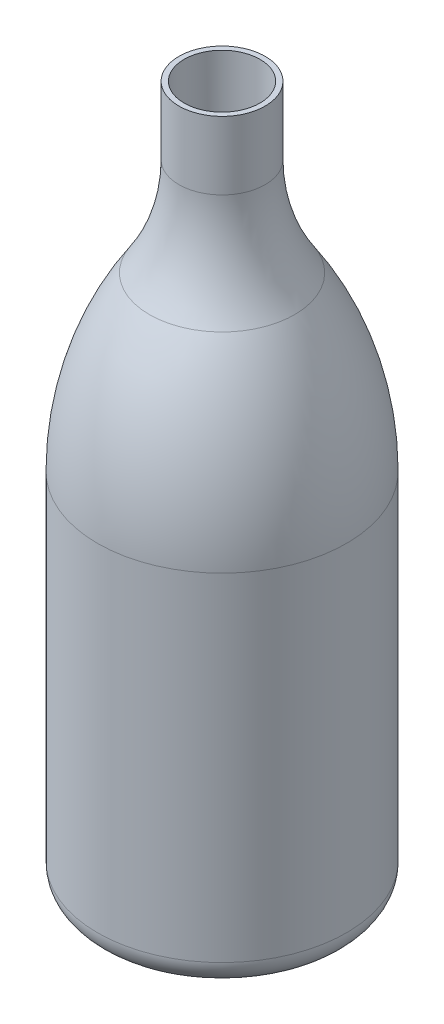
SolidWorks part; units mm, degrees
ref_plane "Front" through (0, 0, 0) normal (0, 0, 1) x (1, 0, 0)
ref_plane "Top" through (0, 0, 0) normal (0, 1, 0) x (1, 0, 0)
ref_plane "Right" through (0, 0, 0) normal (1, 0, 0) x (0, 0, -1)
sketch "Sketch1" plane through (0, 0, 0) normal (0, 0, 1) x (1, 0, 0)
  line L0 (0, 0) -> (24.0891, 0)
  line L1 (24.0891, 0) -> (24.0891, 70.2528)
  line L2 (8.3415, 122.4934) -> (8.3415, 135.6633)
  line L3 (8.3415, 135.6633) -> (0, 135.6633)
  line L4 (0, 135.6633) -> (0, 0)
  arc A0 (24.0891, 70.2528) -> (14.0474, 103.5647) centre (-36.1855, 70.2528) ccw
  arc A1 (14.0474, 103.5647) -> (8.3415, 122.4934) centre (42.5912, 122.4934) cw
revolve "Revolve1" add sketch "Sketch1" angle 360 about L4
fillet "Fillet1" radius 5 1 edges at (0, 0, 24.0891)
shell "Shell1" thickness 1
ref_plane "Plane1" through (0, 0, 30) normal (0, 0, 1) x (1, 0, 0)
sketch "Sketch3" plane through (0, 0, 30) normal (0, 0, 1) x (1, 0, 0)
  text T0 "CADCIM Technologies" font "Century Gothic" height in points 14
